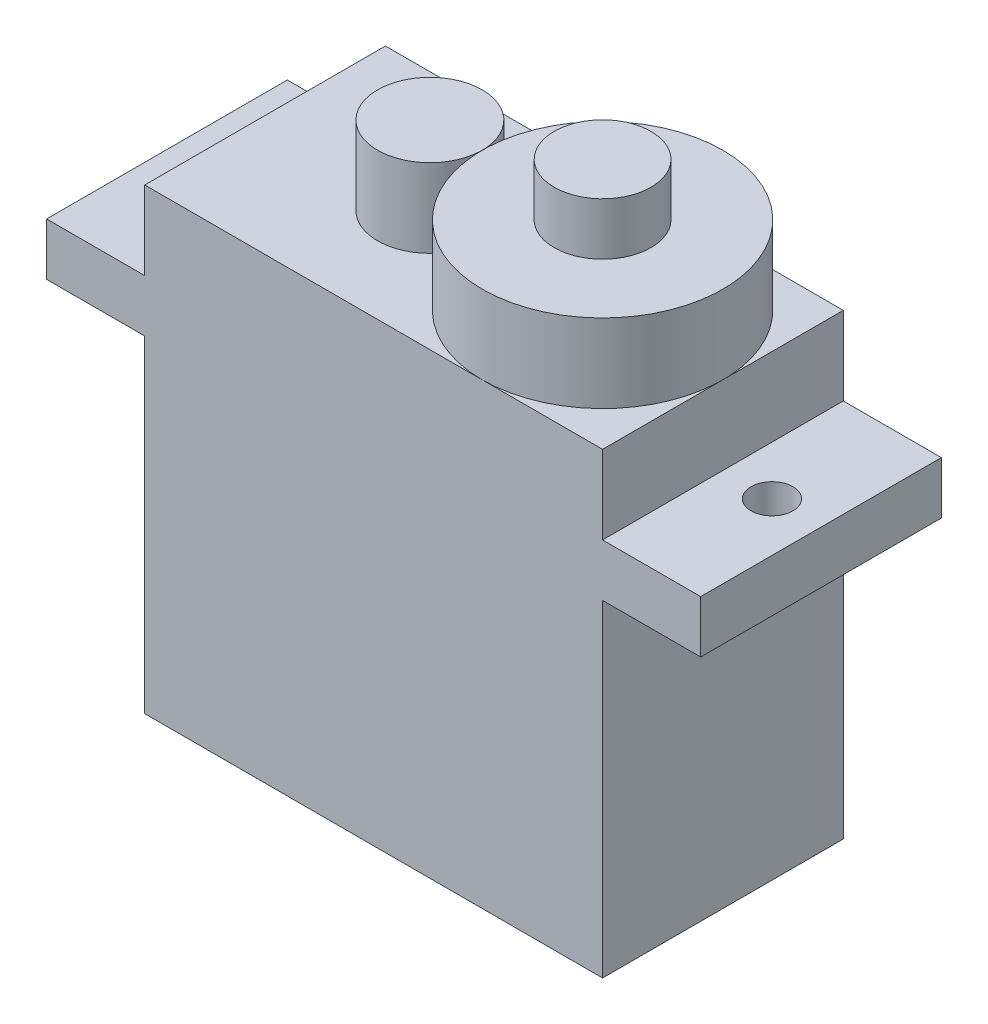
SolidWorks part; units mm, degrees
ref_plane "Front Plane" through (0, 0, 0) normal (0, 0, 1) x (1, 0, 0)
ref_plane "Top Plane" through (0, 0, 0) normal (0, 1, 0) x (1, 0, 0)
ref_plane "Right Plane" through (0, 0, 0) normal (1, 0, 0) x (0, 0, -1)
sketch "Sketch1" plane through (0, 0, 0) normal (0, 1, 0) x (1, 0, 0)
  line L1 (0, 0) -> (31.75, 0)
  line L2 (0, 0) -> (0, 11.684)
  line L3 (0, 11.684) -> (31.75, 11.684)
  line L4 (31.75, 0) -> (31.75, 11.684)
  dimension "D1" = 11.684
  dimension "D2" = 31.75
extrude "Boss-Extrude1" add sketch "Sketch1" along normal blind 2.54
sketch "Sketch2" plane through (0, 2.54, 0) normal (0, 1, 0) x (1, 0, 0)
  line L0 (0, 0) -> (31.75, 0) construction
  line L1 (4.7625, 0) -> (26.9875, 0)
  line L2 (4.7625, 0) -> (4.7625, 11.684)
  line L3 (4.7625, 11.684) -> (26.9875, 11.684)
  line L4 (26.9875, 0) -> (26.9875, 11.684)
  line L5 (31.75, 11.684) -> (0, 11.684) construction
  point P4 (15.875, 0)
  dimension "D1" = 22.225
extrude "Boss-Extrude2" add sketch "Sketch2" along normal blind 3.81
sketch "Sketch3" plane through (0, 6.35, 0) normal (0, 1, 0) x (1, 0, 0)
  line L0 (26.9875, 0) -> (26.9875, 11.684) construction
  line L1 (26.9875, 11.684) -> (4.7625, 11.684) construction
  line L2 (4.7625, 0) -> (26.9875, 0) construction
  circle A0 centre (21.1455, 5.842) radius 5.842
  circle A1 centre (12.7635, 5.842) radius 2.54
  point P8 (15.3035, 5.842)
  point P11 (0, 0)
  point P12 (0, 0)
  dimension "D1" = 5.08
extrude "Boss-Extrude7" add sketch "Sketch3" along normal blind 3.81 contours A1
sketch "Sketch4" plane through (0, 6.35, 0) normal (0, 1, 0) x (1, 0, 0)
  line L0 (26.9875, 0) -> (26.9875, 11.684) construction
  line L1 (4.7625, 0) -> (26.9875, 0) construction
  line L2 (26.9875, 11.684) -> (4.7625, 11.684) construction
  circle A0 centre (21.1455, 5.842) radius 5.842
extrude "Boss-Extrude9" add sketch "Sketch4" along normal blind 3.81 separate body contours A0
sketch "Sketch5" plane through (0, 10.16, 0) normal (0, 1, 0) x (1, 0, 0)
  circle A0 centre (21.1455, 5.842) radius 2.3495
  dimension "D1" = 4.699
extrude "Boss-Extrude10" add sketch "Sketch5" along normal blind 2.54
sketch "Sketch6" plane through (0, 0, 0) normal (0, -1, 0) x (1, 0, 0)
  line L0 (31.75, -11.684) -> (0, -11.684) construction
  line L1 (4.7625, 0) -> (26.9875, 0)
  line L2 (4.7625, 0) -> (4.7625, -11.684)
  line L3 (4.7625, -11.684) -> (26.9875, -11.684)
  line L4 (26.9875, 0) -> (26.9875, -11.684)
  line L5 (0, 0) -> (31.75, 0) construction
  point P4 (15.875, -11.684)
  dimension "D1" = 22.225
extrude "Boss-Extrude11" add sketch "Sketch6" along normal blind 15.875
sketch "Sketch7" plane through (0, 2.54, 0) normal (0, 1, 0) x (1, 0, 0)
  line L0 (15.875, 0) -> (15.875, 11.684) construction
  line L1 (4.7625, 0) -> (26.9875, 0) construction
  line L2 (26.9875, 11.684) -> (4.7625, 11.684) construction
  line L3 (0, 5.842) -> (4.7625, 5.842) construction
  line L4 (0, 11.684) -> (0, 0) construction
  line L5 (4.7625, 11.684) -> (4.7625, 0) construction
  circle A0 centre (2.3813, 5.842) radius 1.016
  circle A1 centre (29.3687, 5.842) radius 1.016
  point P14 (2.3813, 5.842)
  dimension "D1" = 2.032
extrude "Cut-Extrude1" cut sketch "Sketch7" against normal through all
